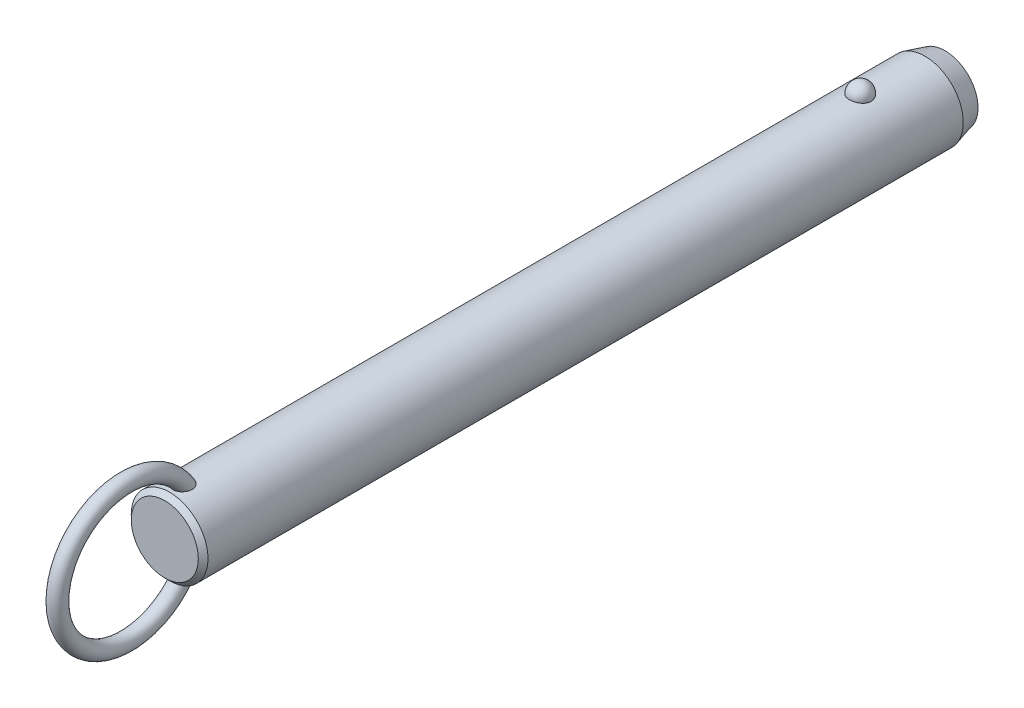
SolidWorks part; units mm, degrees
ref_plane "Front Plane" through (0, 0, 0) normal (0, 0, 1) x (1, 0, 0)
ref_plane "Top Plane" through (0, 0, 0) normal (0, 1, 0) x (1, 0, 0)
ref_plane "Right Plane" through (0, 0, 0) normal (1, 0, 0) x (0, 0, -1)
sketch "Sketch2" plane through (0, 0, 0) normal (0, 0, 1) x (1, 0, 0)
  circle A0 centre (0, 0) radius 9.5
  point P3 (0, 9.5)
  dimension "D1" = 19
extrude "Boss-Extrude1" add sketch "Sketch2" along normal blind 160
sketch "Sketch3" plane through (0, 0, 0) normal (0, 0, -1) x (-1, 0, 0)
  circle A0 centre (0, 0) radius 9.5
  dimension "D1" = 19
extrude "Boss-Extrude2" add sketch "Sketch3" along normal blind 23.7
chamfer "Chamfer1" distance 5 angle 15 1 edges at (-9.5, 0, -23.7)
sketch "Sketch12" plane through (0, 0, 0) normal (1, 0, 0) x (0, 0, -1)
  line L0 (-160, 9.5) -> (-160, -9.5) construction
  point P0 (-160, 0)
sketch "Sketch13" plane through (0, 0, 0) normal (1, 0, 0) x (0, 0, -1)
  circle A0 centre (-179.05, 0) radius 19.05
  point P2 (-160, 0)
  dimension "D1" = 38.1
sketch "Sketch14" plane through (0, 0, 0) normal (0, 1, 0) x (1, 0, 0)
  circle A0 centre (0, -162) radius 2
  point P2 (0, -160)
  dimension "D1" = 4
sweep "Sweep1" add profiles "Sketch14" path "Sketch13"
sketch "Sketch15" plane through (0, 0, 160) normal (0, 0, 1) x (1, 0, 0)
  circle A0 centre (0, 0) radius 9.5
  dimension "D1" = 19
extrude "Boss-Extrude3" add sketch "Sketch15" along normal blind 9.52
chamfer "Chamfer2" distance 1.2 angle 45 1 edges at (9.5, 0, 169.52)
sketch "Sketch18" plane through (0, 0, 0) normal (1, 0, 0) x (0, 0, -1)
  line L0 (18.7, 9.5) -> (-162.5378, 9.5) construction
  line L1 (2.7, 12.2) -> (2.7, 6.8)
  line L2 (-162.5378, -9.5) -> (18.7, -9.5) construction
  arc A0 (2.7, 12.2) -> (2.7, 6.8) centre (2.7, 9.5) ccw
  point P4 (0, 9.5)
  dimension "D1" = 21.7
revolve "Revolve1" add sketch "Sketch18" angle 360 about L1
